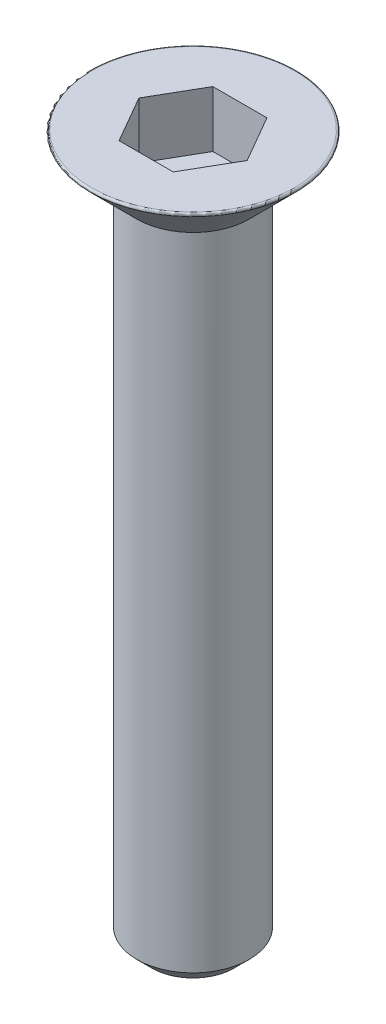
SolidWorks part; units mm, degrees
ref_plane "Plan de face" through (0, 0, 0) normal (0, 0, 1) x (1, 0, 0)
ref_plane "Plan de dessus" through (0, 0, 0) normal (0, 1, 0) x (1, 0, 0)
ref_plane "Plan de droite" through (0, 0, 0) normal (1, 0, 0) x (0, 0, -1)
sketch "Esquisse1" plane through (0, 0, 0) normal (0, 0, 1) x (1, 0, 0)
  line L0 (0, 15.488) -> (0, -29.9279) construction
  line L1 (0, 0) -> (-5.65, 0)
  line L2 (-5.65, 0) -> (-3, -2.65)
  line L3 (-3, -2.65) -> (-3, -37.65)
  line L4 (-3, -37.65) -> (0, -37.65)
  line L5 (0, 0) -> (0, -37.65)
  dimension "D1" = 5.65
  dimension "D2" = 3
  dimension "D3" = 45
  dimension "D4" = 35
revolve "Révolution1" add sketch "Esquisse1" angle 360 about L0
fillet "Congé1" radius 0.1 1 edges at (0, 0, 5.65)
chamfer "Chanfrein1" distance 0.8 angle 45 1 edges at (0, -37.65, 3)
sketch "Esquisse2" plane through (0, 0, 0) normal (0, 1, 0) x (1, 0, 0)
  line L1 (2.8868, 0) -> (1.4434, 2.5)
  line L2 (1.4434, 2.5) -> (-1.4434, 2.5)
  line L3 (-1.4434, 2.5) -> (-2.8868, 0)
  line L4 (-2.8868, 0) -> (-1.4434, -2.5)
  line L5 (-1.4434, -2.5) -> (1.4434, -2.5)
  line L6 (1.4434, -2.5) -> (2.8868, 0)
  circle A0 centre (0, 0) radius 2.5 construction
  dimension "D1" = 5
extrude "Enlèv. mat.-Extru.1" cut sketch "Esquisse2" against normal blind 3
